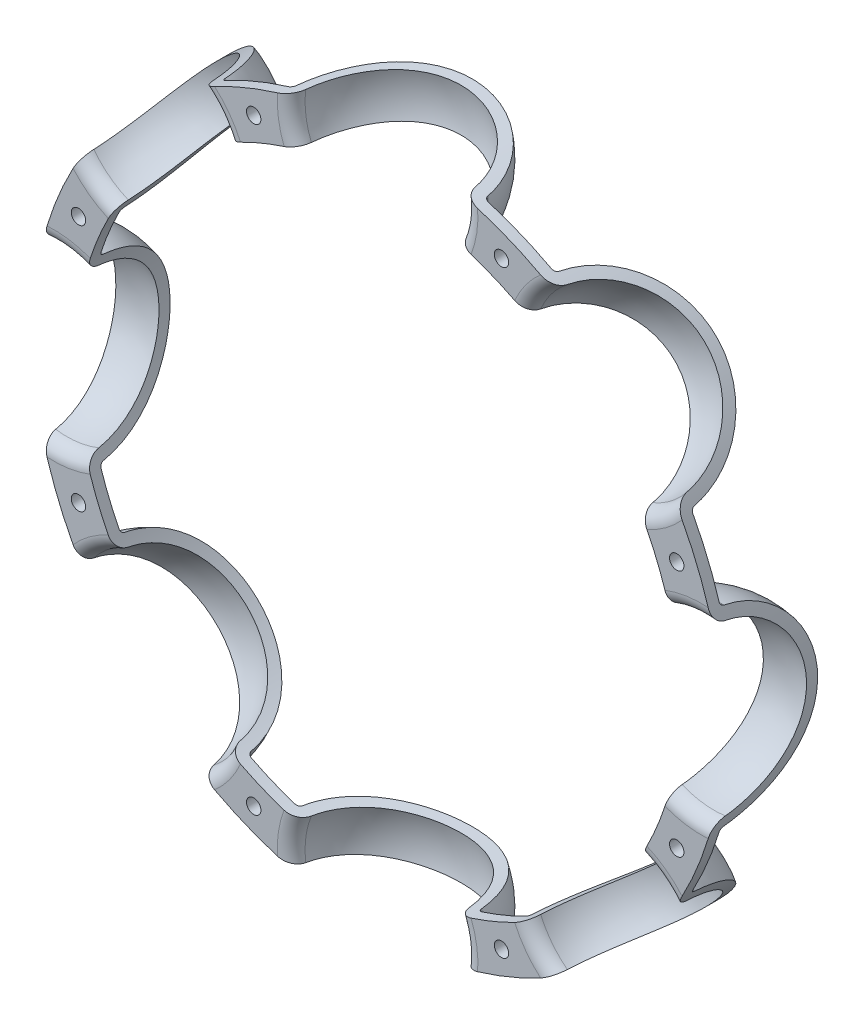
SolidWorks part; units mm, degrees
ref_plane "Front Plane" through (0, 0, 0) normal (0, 0, 1) x (1, 0, 0)
ref_plane "Top Plane" through (0, 0, 0) normal (0, 1, 0) x (1, 0, 0)
ref_plane "Right Plane" through (0, 0, 0) normal (1, 0, 0) x (0, 0, -1)
sketch "Sketch1" plane through (0, 0, 0) normal (0, 0, 1) x (1, 0, 0)
  circle A0 centre (0, 0) radius 42
  circle A1 centre (0, 0) radius 48
  dimension "D1" = 84
  dimension "D2" = 96
extrude "Boss-Extrude1" add sketch "Sketch1" along normal mid plane 16
sketch "Sketch2" plane through (0, 0, 8) normal (0, 0, 1) x (1, 0, 0)
  line L0 (0, 0) -> (0, 60.8456) construction
  line L1 (0, 57) -> (0, 33)
  arc A0 (0, 33) -> (0, 57) centre (0, 45) ccw
  circle A1 centre (0, 0) radius 45 construction
  dimension "D1" = 90
  dimension "D2" = 12
revolve "Cut-Revolve1" cut sketch "Sketch2" angle 360 about L0
fillet "Fillet1" radius 2.1 2 edges at (-11.8995, 43.4499, 8) (11.8995, 43.4499, 8)
pattern_circular "CirPattern1" count 8 over 360 about axis through (0, 0, 0) along (0, 0, 1) of "Cut-Revolve1", "Fillet1"
shell "Shell1" thickness 1.5
sketch "Sketch3" plane through (0, 0, 8) normal (0, 0, 1) x (1, 0, 0)
  line L0 (0, 0) -> (17.2208, 41.5746) construction
  line L1 (0, 0) -> (0, 60.8456) construction
  circle A0 centre (0, 0) radius 45 construction
  circle A1 centre (17.2208, 41.5746) radius 1
  dimension "D1" = 2
  dimension "D2" = 22.5
extrude "Cut-Extrude1" cut sketch "Sketch3" against normal through all
pattern_circular "CirPattern2" count 8 over 360 about axis through (0, 0, 0) along (0, 0, 1) of "Cut-Extrude1"
